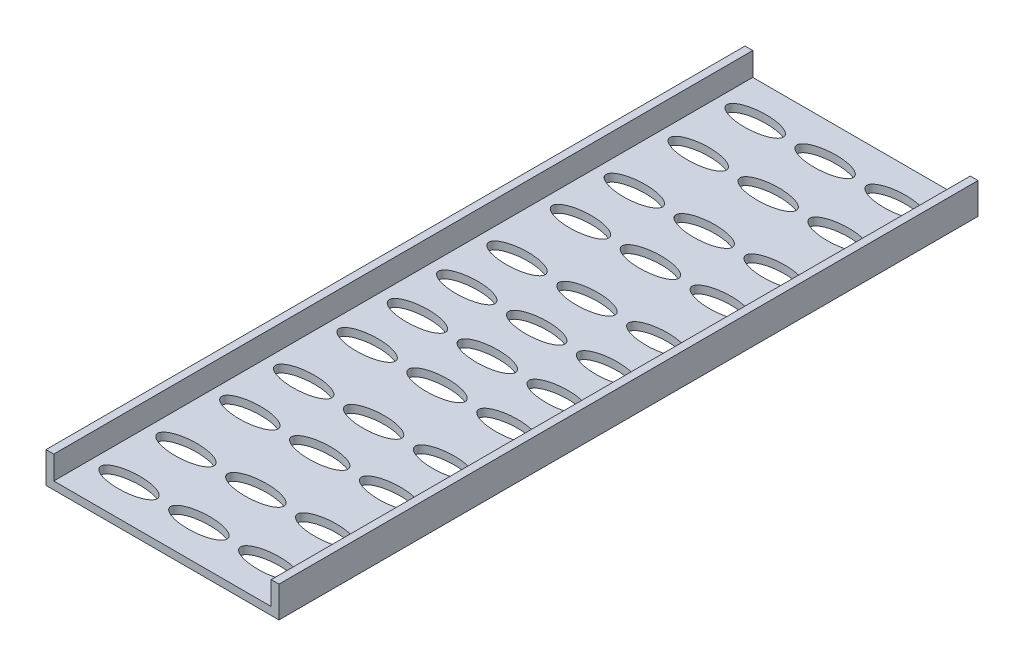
SolidWorks part; units mm, degrees
ref_plane "Plan de face" through (0, 0, 0) normal (0, 0, 1) x (1, 0, 0)
ref_plane "Plan de dessus" through (0, 0, 0) normal (0, 1, 0) x (1, 0, 0)
ref_plane "Plan de droite" through (0, 0, 0) normal (1, 0, 0) x (0, 0, -1)
sketch "Esquisse2" plane through (0, 0, 0) normal (0, 1, 0) x (1, 0, 0)
  line L1 (-15, 0) -> (15, 0)
  line L2 (-15, 0) -> (-15, 90)
  line L3 (-15, 90) -> (15, 90)
  line L4 (15, 0) -> (15, 90)
  dimension "D1" = 90
  dimension "D2" = 30
extrude "Boss.-Extru.1" add sketch "Esquisse2" along normal blind 1
sketch "Esquisse1" plane through (0, 0, 0) normal (0, 1, 0) x (1, 0, 0)
  line L0 (-15, 90) -> (-15, 0)
  line L1 (-15, 0) -> (15, 0)
  line L2 (15, 0) -> (15, 90)
  line L3 (15, 90) -> (-15, 90)
  line L4 (-15, 45) -> (15, 45) construction
  line L5 (0, 90) -> (0, 0) construction
  line L6 (0, 43.2074) -> (0, 40.4338)
  line L7 (0, 28.5686) -> (0, 25.7949)
  line L8 (0, 36.7355) -> (0, 33.9618)
  line L9 (0, 33.9618) -> (-0.152, 33.9204)
  line L10 (0, 21.6344) -> (0, 18.8607)
  line L11 (0, 13.4046) -> (0, 10.6309)
  line L12 (0, 6.071) -> (0, 3.2973)
  ellipse E18 centre (0, 35.3487) end of major axis (3.6332, 35.3487) minor radius 1.3868 (0, 36.7355) -> (0, 33.9618) cw
  ellipse E19 centre (0, 27.1818) end of major axis (3.6332, 27.1818) minor radius 1.3868 (0, 28.5686) -> (0, 25.7949) cw
  ellipse E26 centre (9, 4.6842) end of major axis (5.3668, 4.6842) minor radius 1.3868
  ellipse E27 centre (9, 12.0177) end of major axis (5.3668, 12.0177) minor radius 1.3868
  ellipse E28 centre (9, 20.2476) end of major axis (5.3668, 20.2476) minor radius 1.3868
  ellipse E29 centre (9, 27.1818) end of major axis (5.3668, 27.1818) minor radius 1.3868
  ellipse E30 centre (9, 35.3487) end of major axis (5.3668, 35.3487) minor radius 1.3868
  ellipse E31 centre (9, 41.8206) end of major axis (5.3668, 41.8206) minor radius 1.3868
  ellipse E32 centre (0, 41.8206) end of major axis (3.6332, 41.8206) minor radius 1.3868 (0, 43.2074) -> (0, 40.4338) cw
  ellipse E33 centre (0, 20.2476) end of major axis (3.6332, 20.2476) minor radius 1.3868 (0, 21.6344) -> (0, 18.8607) cw
  ellipse E34 centre (0, 12.0177) end of major axis (3.6332, 12.0177) minor radius 1.3868 (0, 13.4046) -> (0, 10.6309) cw
  ellipse E35 centre (0, 4.6842) end of major axis (3.6332, 4.6842) minor radius 1.3868 (0, 6.071) -> (0, 3.2973) cw
extrude "Enlèv. mat.-Extru.3" cut sketch "Esquisse1" along normal through all contours E33 L10 | E34 L11 | E35 L12 | E19 L7 | E18 L8 | E31 | E30 | E29 | E28 | E26 | E32 L6 | E27
mirror "Symétrie1" about plane through (0, 0, 0) normal (1, 0, 0) of "Enlèv. mat.-Extru.3"
ref_plane "Plan1" through (0, 0, -45) normal (0, 0, 1) x (1, 0, 0)
mirror "Symétrie2" about plane through (0, 0, -45) normal (0, 0, 1) of "Symétrie1", "Enlèv. mat.-Extru.3"
sketch "Esquisse3" plane through (0, 1, 0) normal (0, 1, 0) x (1, 0, 0)
  line L1 (-15, 90) -> (-15, 0) construction
  line L2 (15, 0) -> (15, 90) construction
  line L4 (-14, 90) -> (-14, 0)
  line L5 (-15, 90) -> (-15, 0)
  line L6 (15, 0) -> (15, 90)
  line L7 (14, 0) -> (14, 90)
  line L8 (-15, 0) -> (15, 0) construction
  line L9 (15, 90) -> (-15, 90) construction
  line L10 (-15, 0) -> (15, 0)
  line L11 (15, 90) -> (-15, 90)
  dimension "D1" = 1
extrude "Boss.-Extru.2" add sketch "Esquisse3" along normal blind 3 contours L4 M18 M15 M16 | L7 M16 M17 M18
